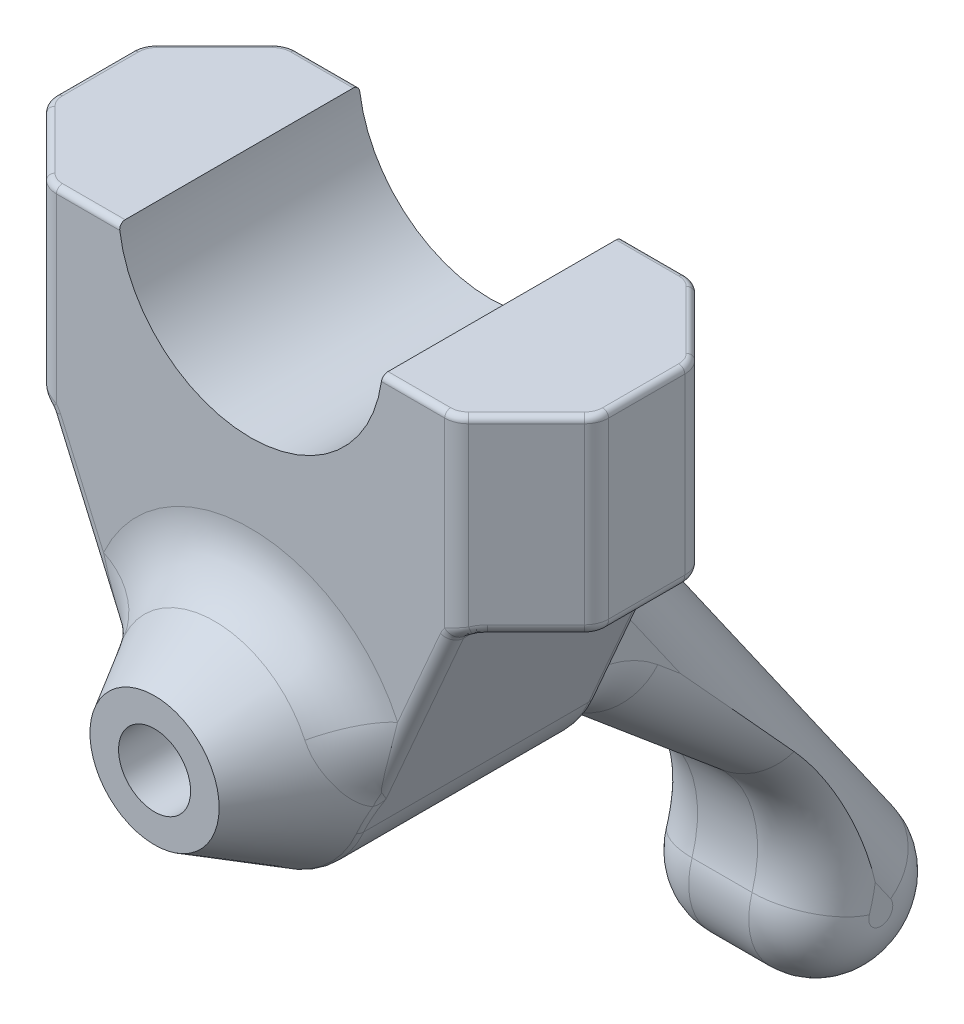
SolidWorks part; units mm, degrees
ref_plane "Plan de face" through (0, 0, 0) normal (0, 0, 1) x (1, 0, 0)
ref_plane "Plan de dessus" through (0, 0, 0) normal (0, 1, 0) x (1, 0, 0)
ref_plane "Plan de droite" through (0, 0, 0) normal (1, 0, 0) x (0, 0, -1)
sketch "Esquisse1" plane through (0, 0, 0) normal (0, 0, 1) x (1, 0, 0)
  line L0 (-10.9545, -1) -> (-23, -1)
  line L1 (-23, -1) -> (-23, -17)
  line L2 (-23, -17) -> (-17, -17)
  line L3 (-17, -17) -> (-9.1691, -34.991)
  line L4 (23, -17) -> (23, -1)
  line L5 (23, -1) -> (10.9545, -1)
  line L6 (0, 8.5194) -> (0, -32.293) construction
  line L7 (9.1691, -34.991) -> (17, -17)
  line L8 (17, -17) -> (23, -17)
  arc A0 (-10.9545, -1) -> (10.9545, -1) centre (0, 0) ccw
  arc A1 (-9.1691, -34.991) -> (9.1691, -34.991) centre (0, -31) ccw
  dimension "D1" = 22
  dimension "D4" = 16
  dimension "D5" = 10
  dimension "D6" = 41
  dimension "D2" = 1
  dimension "D3" = 46
  dimension "D7" = 34
extrude "Boss.-Extru.1" add sketch "Esquisse1" along normal mid plane 20
chamfer "Chanfrein1" distance 6 angle 45 4 edges at (-23, -9, 10) (23, -9, 10) (23, -9, -10) (-23, -9, -10)
fillet "Congé1" radius 2 8 edges at (17, -9, -10) (23, -9, -4) (23, -9, 4) (17, -9, 10) (-17, -9, 10) (-23, -9, 4) (-17, -9, -10) (-23, -9, -4)
fillet "Congé3" radius 0.5 18 edges at (13.563, -1, 10) (16.9369, -1, 9.8478) (20, -1, 7) (22.8478, -1, 3.9369) (23, -1, 0) (22.8478, -1, -3.9369) (20, -1, -7) (16.9369, -1, -9.8478) (-13.563, -1, -10) (-16.9369, -1, -9.8478) (-13.563, -1, 10) (-16.9369, -1, 9.8478) (-20, -1, 7) (-22.8478, -1, 3.9369) (-23, -1, 0) (-22.8478, -1, -3.9369) (13.563, -1, -10) (-20, -1, -7)
sketch "Esquisse5" plane through (0, 0, 10) normal (0, 0, 1) x (1, 0, 0)
  circle A0 centre (0, -31) radius 10
extrude "Boss.-Extru.3" add sketch "Esquisse5" along normal blind 8 draft 30
sketch "Esquisse6" plane through (0, 0, 18) normal (0, 0, 1) x (1, 0, 0)
  circle A0 centre (0, -31) radius 3
  dimension "D1" = 6
extrude "Enlèv. mat.-Extru.1" cut sketch "Esquisse6" against normal blind 9
fillet "Congé4" radius 1 2 edges at (17, -17, 0) (-17, -17, 0)
fillet "Congé5" radius 1 28 edges at (-16.458, -18.2453, 9.9794) (-16.9893, -17.2541, 9.8252) (-17.6205, -17.0006, 9.3795) (-20.0348, -17, 6.9652) (-22.8478, -17, 3.9369) (-23, -17, 0) (-22.8478, -17, -3.9369) (-20.0348, -17, -6.9652) (-17.6205, -17.0006, -9.3795) (-17.1356, -17.1457, -9.7523) (-16.458, -18.2453, -9.9794) (-12.6703, -26.9471, -10) (0, -41, -10) (12.6703, -26.9471, -10) (16.458, -18.2453, -9.9794) (16.9893, -17.2541, -9.8252) (17.6205, -17.0006, -9.3795) (20.0348, -17, -6.9652) (22.8478, -17, -3.9369) (23, -17, 0) (22.8478, -17, 3.9369) (20.0348, -17, 6.9652) (17.6205, -17.0006, 9.3795) (17.1356, -17.1457, 9.7523) (16.458, -18.2453, 9.9794) (12.6703, -26.9471, 10) (0, -41, 10) (-12.6703, -26.9471, 10)
fillet "Congé6" radius 6 5 edges at (-10.2695, -32.349, 9.2979) (-10.0691, -31.8664, 9.8159) (10.2783, -32.3667, 9.2444) (10.097, -32.0404, 9.7395) (0, -21, 10)
sketch "Esquisse8" plane through (0, 0, 0) normal (1, 0, 0) x (0, 0, -1)
  line L0 (10, -25) -> (12.4137, -25)
  line L1 (10, -34.5919) -> (10, -17.2018) construction
  line L2 (16.5095, -27.1321) -> (39.9149, -60.5585)
  line L3 (26.1655, -51.5374) -> (13.2139, -40.6698)
  line L4 (10, -39.5) -> (10, -25)
  line L5 (9.0607, -1) -> (4.2322, -1) construction
  line L6 (10, -16.659) -> (10, -1.5) construction
  line L7 (10, -40) -> (10, -34.5919) construction
  line L8 (-9.7321, -41) -> (9, -41) construction
  arc A0 (39.9149, -60.5585) -> (29.2766, -62.1992) centre (35, -64) cw
  arc A1 (29.2766, -62.1992) -> (26.1655, -51.5374) centre (19.7376, -59.1979) ccw
  arc A2 (13.2139, -40.6698) -> (10, -39.5) centre (10, -44.5) ccw
  arc A3 (12.4137, -25) -> (16.5095, -27.1321) centre (12.4137, -30) cw
  dimension "D1" = 6
  dimension "D3" = 5
  dimension "D7" = 5
  dimension "D9" = 10
  dimension "D2" = 24
  dimension "D4" = 145
  dimension "D5" = 25
  dimension "D6" = 1.5
  dimension "D8" = 63
  dimension "D10" = 15
extrude "Boss.-Extru.4" add sketch "Esquisse8" along normal mid plane 15
fillet "Congé7" radius 5 7 edges at (-7.5, -39.8015, -11.7101) (-7.5, -25, -11.2069) (-7.5, -25.5649, -14.7225) (-7.5, -43.8453, -28.2122) (-7.5, -69.9299, -35.9145) (-7.5, -56.3967, -29.3373) (-7.5, -46.1036, -19.6897)
fillet "Congé8" radius 5 7 edges at (7.5, -39.8015, -11.7101) (7.5, -25, -11.2069) (7.5, -25.5649, -14.7225) (7.5, -43.8453, -28.2122) (7.5, -69.9299, -35.9145) (7.5, -56.3967, -29.3373) (7.5, -46.1036, -19.6897)
